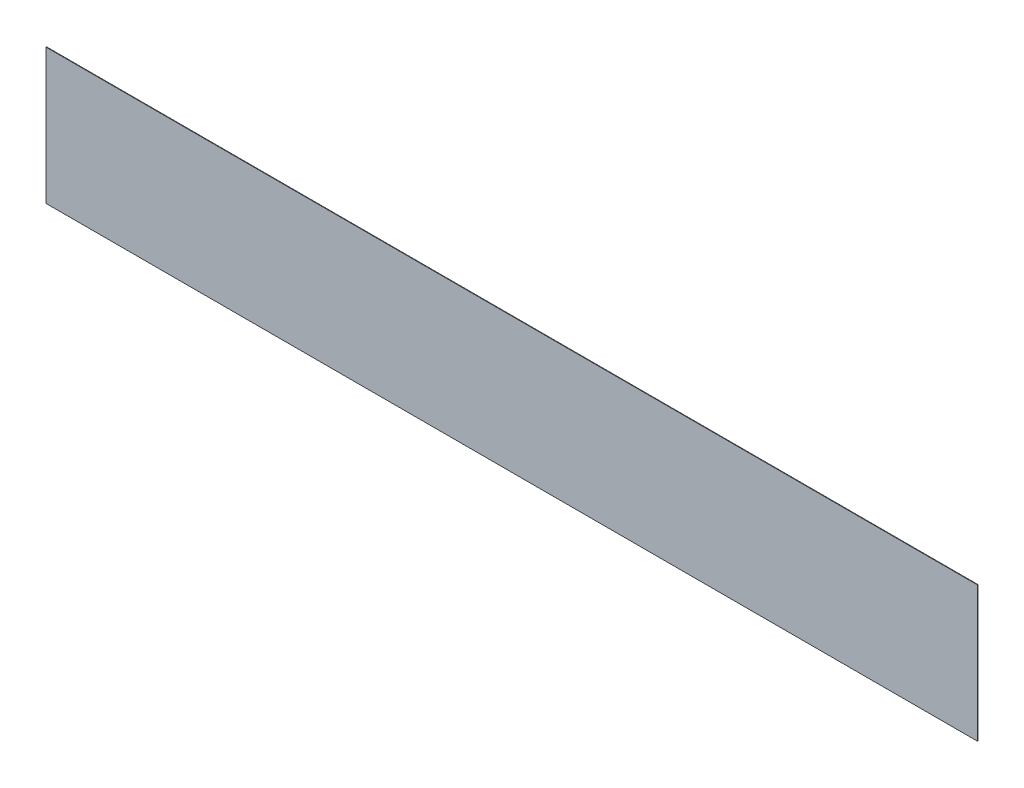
SolidWorks part; units mm, degrees
ref_plane "Front Plane" through (0, 0, 0) normal (0, 0, 1) x (1, 0, 0)
ref_plane "Top Plane" through (0, 0, 0) normal (0, 1, 0) x (1, 0, 0)
ref_plane "Right Plane" through (0, 0, 0) normal (1, 0, 0) x (0, 0, -1)
sketch "Sketch1" plane through (0, 0, 0) normal (0, 0, 1) x (1, 0, 0)
  line L0 (10, 0) -> (-5, 0) construction
  line L1 (7, 0) -> (179, 0)
  line L2 (7, 0) -> (7, 25)
  line L3 (7, 25) -> (179, 25)
  line L4 (179, 0) -> (179, 25)
  line L5 (10, 25) -> (2, 25) construction
  line L6 (8, 2) -> (8, 23) construction
  point P10 (179, 12.5)
  dimension "D1" = 1
  dimension "D2" = 172
extrude "Boss-Extrude1" add sketch "Sketch1" along normal blind 0.1
